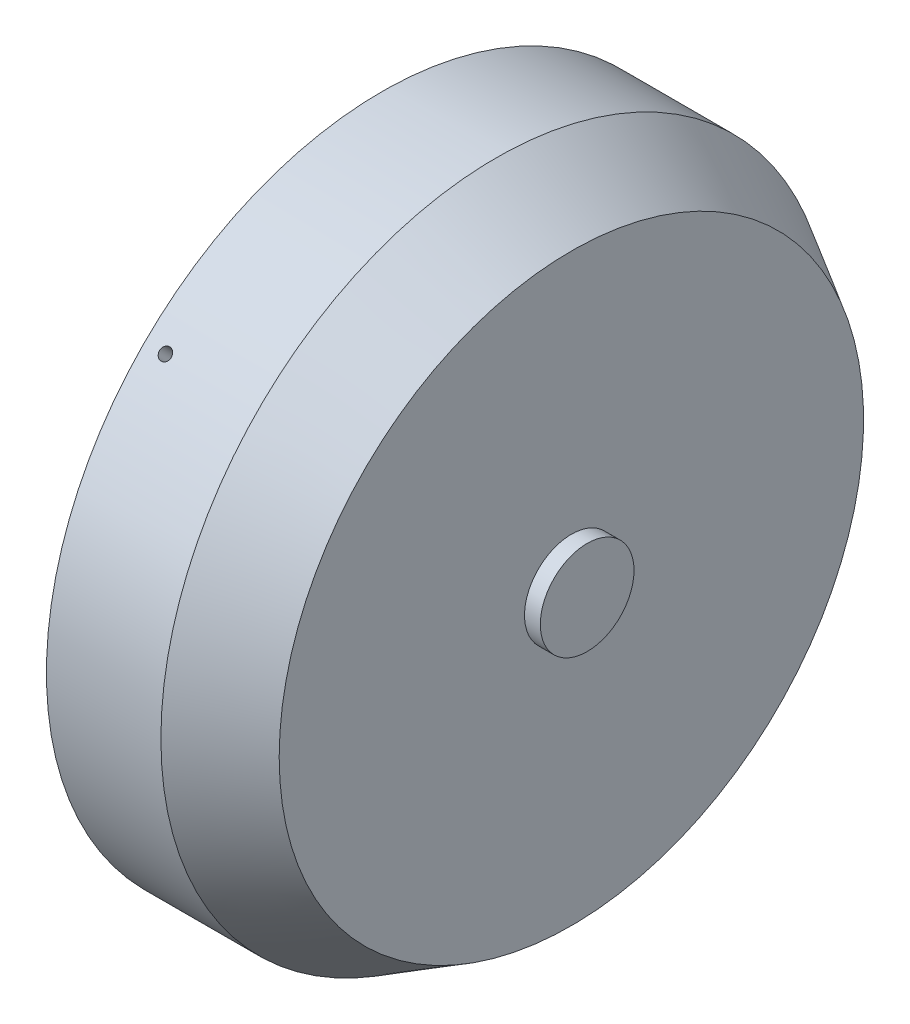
SolidWorks part; units mm, degrees
ref_plane "Face" through (0, 0, 0) normal (0, 0, 1) x (1, 0, 0)
ref_plane "Dessus" through (0, 0, 0) normal (0, 1, 0) x (1, 0, 0)
ref_plane "Droite" through (0, 0, 0) normal (1, 0, 0) x (0, 0, -1)
imported_body "Importée1"
scale "Echelle1"
